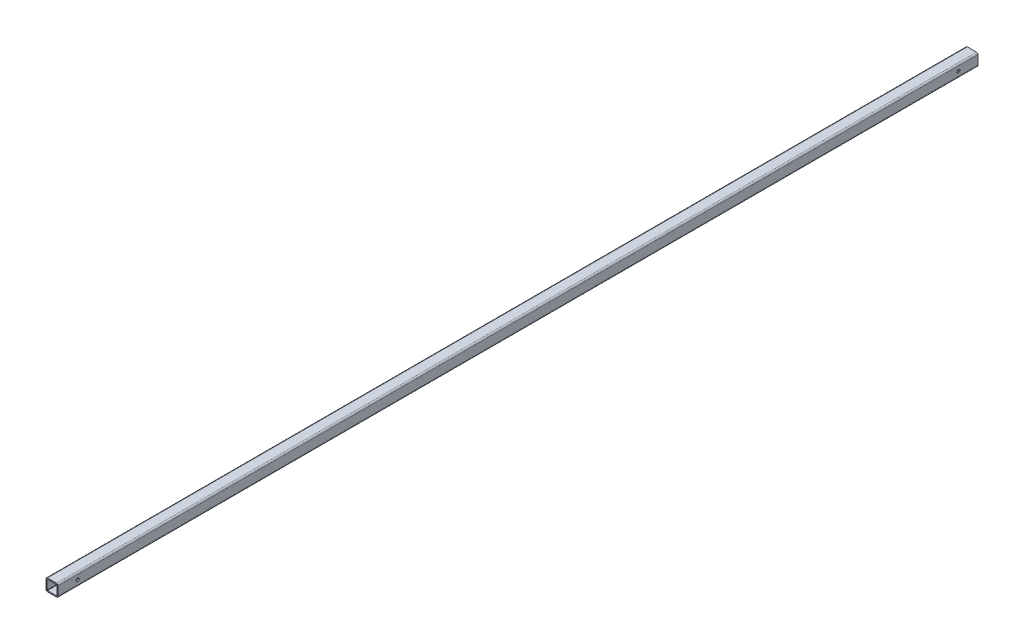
SolidWorks part; units mm, degrees
ref_plane "Plan de face" through (0, 0, 0) normal (0, 0, 1) x (1, 0, 0)
ref_plane "Plan de dessus" through (0, 0, 0) normal (0, 1, 0) x (1, 0, 0)
ref_plane "Plan de droite" through (0, 0, 0) normal (1, 0, 0) x (0, 0, -1)
sketch "Esquisse1" plane through (0, 0, 0) normal (0, 0, 1) x (1, 0, 0)
  line L0 (-6.5, 6) -> (-6.5, -6)
  line L1 (-6, 8) -> (6, 8)
  line L2 (-8, 6) -> (-8, -6)
  line L3 (-6, -8) -> (6, -8)
  line L4 (8, 6) -> (8, -6)
  line L5 (-6, -6.5) -> (6, -6.5)
  line L6 (6.5, 6) -> (6.5, -6)
  line L7 (-6, 6.5) -> (6, 6.5)
  arc A0 (6, -8) -> (8, -6) centre (6, -6) ccw
  arc A1 (-8, -6) -> (-6, -8) centre (-6, -6) ccw
  arc A2 (-6, 8) -> (-8, 6) centre (-6, 6) ccw
  arc A3 (6, 8) -> (8, 6) centre (6, 6) cw
  arc A4 (-6.5, -6) -> (-6, -6.5) centre (-6, -6) ccw
  arc A5 (6, -6.5) -> (6.5, -6) centre (6, -6) ccw
  arc A6 (6, 6.5) -> (6.5, 6) centre (6, 6) cw
  arc A7 (-6, 6.5) -> (-6.5, 6) centre (-6, 6) ccw
  dimension "D5" = 2
  dimension "D1" = 8
  dimension "D2" = 16
  dimension "D3" = 8
  dimension "D4" = 16
  dimension "D6" = 1.5
extrude "Boss.-Extru.1" add sketch "Esquisse1" along normal blind 1220
sketch "Esquisse2" plane through (8, 0, 0) normal (1, 0, 0) x (0, 0, -1)
  line L0 (-1220, -6) -> (-1220, 6) construction
  line L1 (0, -6) -> (0, 6) construction
  circle A0 centre (-1194, 0) radius 2
  circle A1 centre (-26, 0) radius 2
  dimension "D2" = 4
  dimension "D3" = 4
  dimension "D1" = 26
  dimension "D4" = 26
extrude "Enlèv. mat.-Extru.1" cut sketch "Esquisse2" against normal through all
